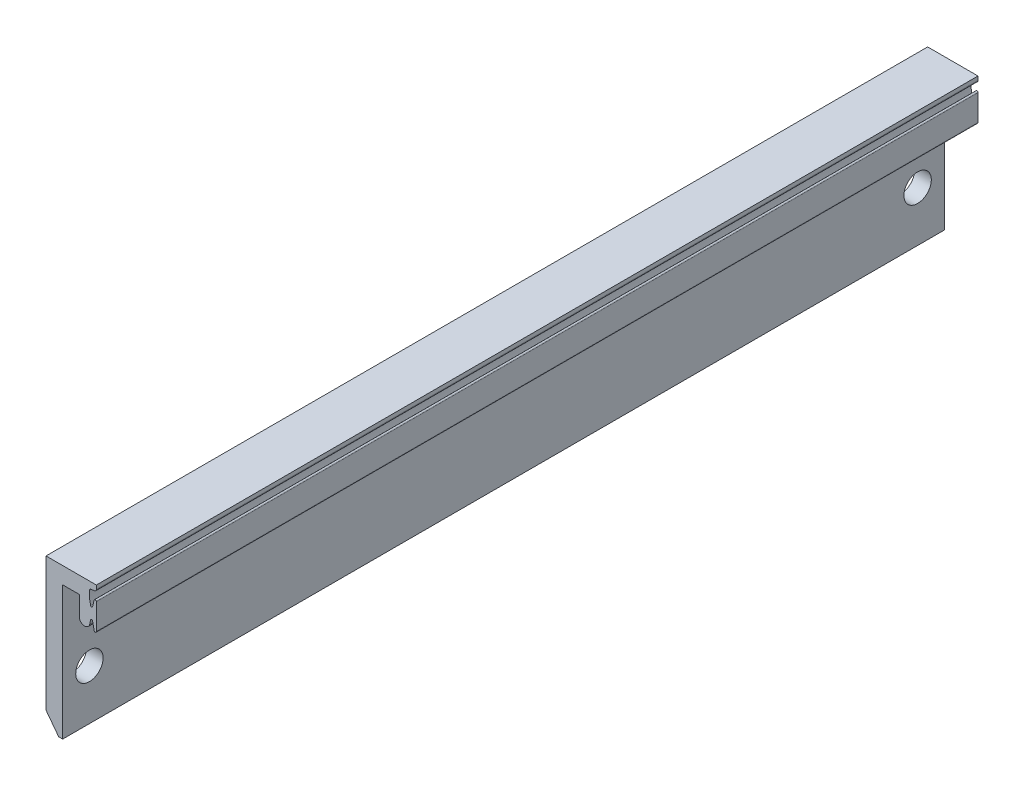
SolidWorks part; units mm, degrees
ref_plane "前视基准面" through (0, 0, 0) normal (0, 0, 1) x (1, 0, 0)
ref_plane "上视基准面" through (0, 0, 0) normal (0, 1, 0) x (1, 0, 0)
ref_plane "右视基准面" through (0, 0, 0) normal (1, 0, 0) x (0, 0, -1)
sketch "草图1" plane through (0, 0, 0) normal (0, 0, 1) x (1, 0, 0)
  line L1704 (2468.3526, -3235.8771) -> (2475.8926, -3235.8771)
  line L1705 (2470.8526, -3238.3771) -> (2473.3526, -3238.3771)
  line L1706 (2468.3526, -3235.8771) -> (2468.3526, -3255.8771)
  line L1707 (2470.8526, -3238.3771) -> (2470.8526, -3258.3771)
  line L1708 (2470.8526, -3258.3771) -> (2470.2526, -3258.3771)
  line L1709 (2468.3526, -3255.8771) -> (2470.2526, -3258.3771)
  line L1710 (2473.3526, -3238.3771) -> (2473.3526, -3241.2434)
  line L1711 (2473.3526, -3238.3771) -> (2473.3526, -3241.2938)
  line L1712 (2475.8926, -3238.0396) -> (2475.8926, -3241.8646)
  line L1713 (2474.9017, -3241.456) -> (2475.0378, -3240.8129)
  line L1714 (2475.8926, -3238.0529) -> (2475.8926, -3241.9013)
  line L1715 (2475.0915, -3236.8368) -> (2475.6405, -3236.7479)
  line L1716 (2475.3296, -3240.8224) -> (2475.5558, -3241.9417)
  line L1717 (2475.5569, -3238.0076) -> (2475.3287, -3238.9862)
  line L1718 (2475.8926, -3235.8771) -> (2475.8926, -3236.4518)
  arc A580 (2474.8396, -3237.1209) -> (2475.0336, -3238.9696) centre (2481.2807, -3237.3796) ccw
  arc A581 (2475.6405, -3236.7479) -> (2475.8926, -3236.4518) centre (2475.5926, -3236.4518) ccw
  arc A582 (2475.0915, -3236.8368) -> (2474.8396, -3237.1209) centre (2475.1394, -3237.133) ccw
  arc A583 (2475.3296, -3240.8224) -> (2475.0343, -3240.8293) centre (2475.1826, -3240.8521) ccw
  arc A584 (2475.5558, -3241.9417) -> (2475.8926, -3241.9013) centre (2475.7226, -3241.908) ccw
  arc A585 (2475.0336, -3238.9696) -> (2475.3287, -3238.9862) centre (2475.1826, -3238.9521) ccw
  arc A586 (2475.8926, -3238.0529) -> (2475.5569, -3238.0076) centre (2475.7226, -3238.0462) ccw
  arc A587 (2473.3526, -3241.2938) -> (2474.9017, -3241.456) centre (2474.1356, -3241.2938) ccw
extrude "凸台-拉伸1" add sketch "草图1" along normal mid plane 132 contours L1711 A587 L1713 A583 L1716 A584 L1714 L1712 A586 L1717 A585 A580 A582 L1715 A581 L1718 L1704 L1706 L1709 L1708 L1707 L1705 L1710
sketch "草图2" plane through (2468.3526, 0, 0) normal (-1, 0, 0) x (0, 0, 1)
  line L0 (-66, -3235.8771) -> (-66, -3255.8771) construction
  line L1 (66, -3235.8771) -> (-66, -3235.8771) construction
  line L2 (0, -3235.8771) -> (0, -3258.3771) construction
  line L3 (66, -3258.3771) -> (-66, -3258.3771) construction
  circle A0 centre (-62, -3250.8771) radius 2.05
  circle A1 centre (62, -3250.8771) radius 2.05
  dimension "D1" = 4.1
  dimension "D2" = 4
  dimension "D3" = 15
extrude "切除-拉伸1" cut sketch "草图2" against normal through all
equation "\"切除-拉伸2\" = if ( \"D1@凸台-拉伸1\" = 265.35 , \"unsuppressed\" , \"suppressed\" )"
